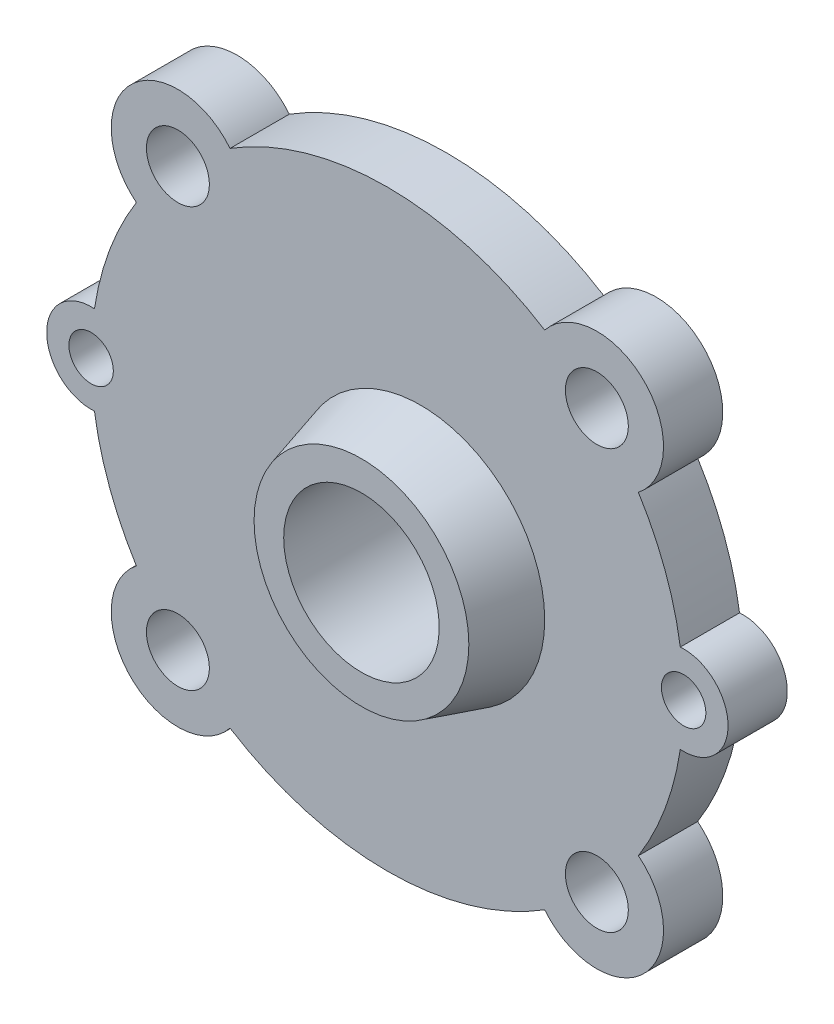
SolidWorks part; units mm, degrees
ref_plane "前视基准面" through (0, 0, 0) normal (0, 0, 1) x (1, 0, 0)
ref_plane "上视基准面" through (0, 0, 0) normal (0, 1, 0) x (1, 0, 0)
ref_plane "右视基准面" through (0, 0, 0) normal (1, 0, 0) x (0, 0, -1)
ref_plane "基准面1" through (0, 0, 2) normal (0, 0, 1) x (1, 0, 0)
sketch "草图1" plane through (0, 0, 2) normal (0, 0, 1) x (1, 0, 0)
  arc A0 (33.8919, 21.2448) -> (21.2448, 33.8919) centre (28.2843, 28.2843) ccw construction
  arc A1 (39.55, 5.9831) -> (33.8919, 21.2448) centre (0, 0) ccw construction
  arc A2 (39.55, -5.9831) -> (39.55, 5.9831) centre (40, 0) ccw construction
  arc A3 (33.8919, -21.2448) -> (39.55, -5.9831) centre (0, 0) ccw construction
  arc A4 (21.2448, -33.8919) -> (33.8919, -21.2448) centre (28.2843, -28.2843) ccw construction
  arc A5 (-21.2448, -33.8919) -> (21.2448, -33.8919) centre (0, 0) ccw construction
  arc A6 (-33.8919, -21.2448) -> (-21.2448, -33.8919) centre (-28.2843, -28.2843) ccw construction
  arc A7 (-39.55, -5.9831) -> (-33.8919, -21.2448) centre (0, 0) ccw construction
  arc A8 (-39.55, 5.9831) -> (-39.55, -5.9831) centre (-40, 0) ccw construction
  arc A9 (-33.8919, 21.2448) -> (-39.55, 5.9831) centre (0, 0) ccw construction
  arc A10 (-21.2448, 33.8919) -> (-33.8919, 21.2448) centre (-28.2843, 28.2843) ccw construction
  arc A11 (21.2448, 33.8919) -> (-21.2448, 33.8919) centre (0, 0) ccw construction
  arc A12 (33.8919, 21.2448) -> (21.2448, 33.8919) centre (28.2843, 28.2843) ccw
  arc A13 (39.55, 5.9831) -> (33.8919, 21.2448) centre (0, 0) ccw
  arc A14 (39.55, -5.9831) -> (39.55, 5.9831) centre (40, 0) ccw
  arc A15 (33.8919, -21.2448) -> (39.55, -5.9831) centre (0, 0) ccw
  arc A16 (21.2448, -33.8919) -> (33.8919, -21.2448) centre (28.2843, -28.2843) ccw
  arc A17 (-21.2448, -33.8919) -> (21.2448, -33.8919) centre (0, 0) ccw
  arc A18 (-33.8919, -21.2448) -> (-21.2448, -33.8919) centre (-28.2843, -28.2843) ccw
  arc A19 (-39.55, -5.9831) -> (-33.8919, -21.2448) centre (0, 0) ccw
  arc A20 (-39.55, 5.9831) -> (-39.55, -5.9831) centre (-40, 0) ccw
  arc A21 (-33.8919, 21.2448) -> (-39.55, 5.9831) centre (0, 0) ccw
  arc A22 (-21.2448, 33.8919) -> (-33.8919, 21.2448) centre (-28.2843, 28.2843) ccw
  arc A23 (21.2448, 33.8919) -> (-21.2448, 33.8919) centre (0, 0) ccw
  circle A24 centre (4.5, 0) radius 10.5 construction
  circle A25 centre (4.5, 0) radius 10.5
extrude "拉伸1" add sketch "草图1" along normal blind 8
hole_wizard "M10 螺纹孔1" positions "草图3" profile "草图2" tap size "M10" standard "ISO"
sketch "草图3" plane through (0, 0, 10) normal (0, 0, 1) x (1, 0, 0)
  point P1 (-28.2843, 28.2843)
  point P4 (-28.2843, -28.2843)
  point P7 (28.2843, 28.2843)
  point P10 (28.2843, -28.2843)
sketch "草图2" plane through (-28.2843, 28.2843, 10) normal (1, 0, 0) x (0, -1, 0)
  line L0 (0, 0) -> (0, 10.5537)
  line L1 (0, 10.5537) -> (4.25, 8)
  line L2 (4.25, 8) -> (4.25, 0)
  line L5 (4.25, 0) -> (0, 0)
  line L10 (0, 10.5537) -> (-4.25, 8) construction
  line L11 (0, -6.35) -> (0, 107.95) construction
  dimension "蹟恇謂郰芛眻噤" = 8.5
  dimension "蹟恇謂郰芛旮僅" = 8
  dimension "絳芛褒僅" = 118
sketch "草图4" plane through (0, 0, 10) normal (0, 0, 1) x (1, 0, 0)
  circle A0 centre (-40, 0) radius 3
  circle A1 centre (40, 0) radius 3
  dimension "D1" = 6
  dimension "D2" = 6
extrude "切除-拉伸1" cut sketch "草图4" against normal through all
sketch "草图5" plane through (0, 0, 0) normal (0, 1, 0) x (-1, 0, 0)
  line L0 (-4.5, -29) -> (-4.5, 41.2454) construction
  line L1 (-15, 10) -> (-15, 18)
  line L2 (-15, 18) -> (-19, 18)
  line L3 (-19, 18) -> (-21.2448, 10)
  line L4 (21.2448, 10) -> (-21.2448, 10) construction
  line L5 (-15, 10) -> (-21.2448, 10)
  arc A0 (-7.5, -26) -> (-1.5, -26) centre (-4.5, -26) ccw construction
  dimension "D1" = 8
  dimension "D2" = 4
revolve "旋转1" add sketch "草图5" angle 360 about L0
